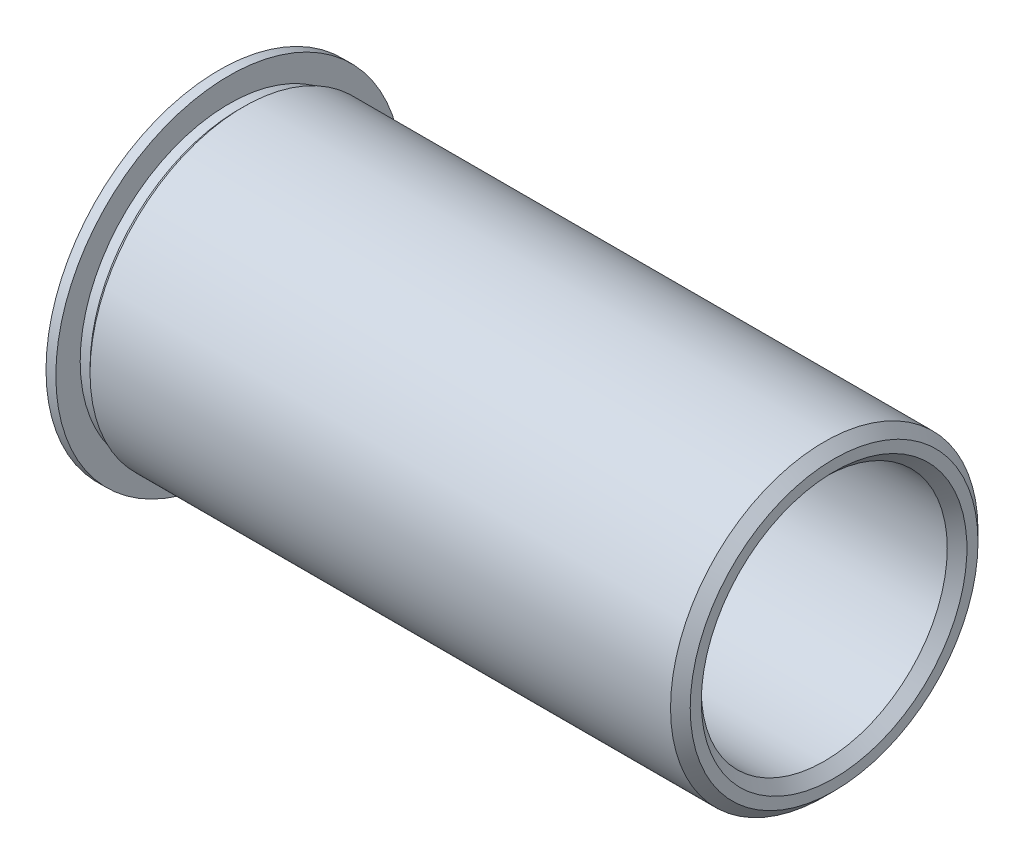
SolidWorks part; units mm, degrees
ref_plane "Front Plane" through (0, 0, 0) normal (0, 0, 1) x (1, 0, 0)
ref_plane "Top Plane" through (0, 0, 0) normal (0, 1, 0) x (1, 0, 0)
ref_plane "Right Plane" through (0, 0, 0) normal (1, 0, 0) x (0, 0, -1)
sketch "Sketch2" plane through (0, 0, 0) normal (0, 0, 1) x (1, 0, 0)
  line L0 (-60.9661, 94.6527) -> (-60.9661, 99.1231)
  line L1 (-60.9661, 99.1231) -> (-60.7121, 99.1231)
  line L2 (-60.9661, 94.6527) -> (-45.0911, 94.6527)
  line L3 (-45.0911, 94.6527) -> (-45.0911, 98.3674)
  line L4 (-45.0911, 98.3674) -> (-45.3451, 98.6214)
  line L5 (-45.3451, 98.6214) -> (-60.3311, 98.6214)
  line L6 (-60.3311, 98.6214) -> (-60.4581, 98.4944)
  line L7 (-60.4581, 98.4944) -> (-60.7121, 98.4944)
  line L8 (-60.7121, 98.4944) -> (-60.7121, 99.1231)
  dimension "D1" = 4.4704
  dimension "D2" = 0.254
  dimension "D3" = 3.9688
  dimension "D4" = 0.254
  dimension "D5" = 0.254
  dimension "D6" = 15.875
  dimension "D7" = 0.127
  dimension "D8" = 0.254
revolve "Revolve3" add sketch "Sketch2" angle 360 about L2
sketch "Sketch3" plane through (-45.0911, 0, 0) normal (1, 0, 0) x (0, 0, -1)
  circle A0 centre (0, 94.6527) radius 3.175
  dimension "D1" = 6.35
extrude "Cut-Extrude1" cut sketch "Sketch3" against normal through all
chamfer "Chamfer2" distance 0.254 angle 45 1 edges at (-60.9661, 94.6527, -3.175)
chamfer "Chamfer3" distance 0.254 angle 45 1 edges at (-45.0911, 94.6527, -3.175)
